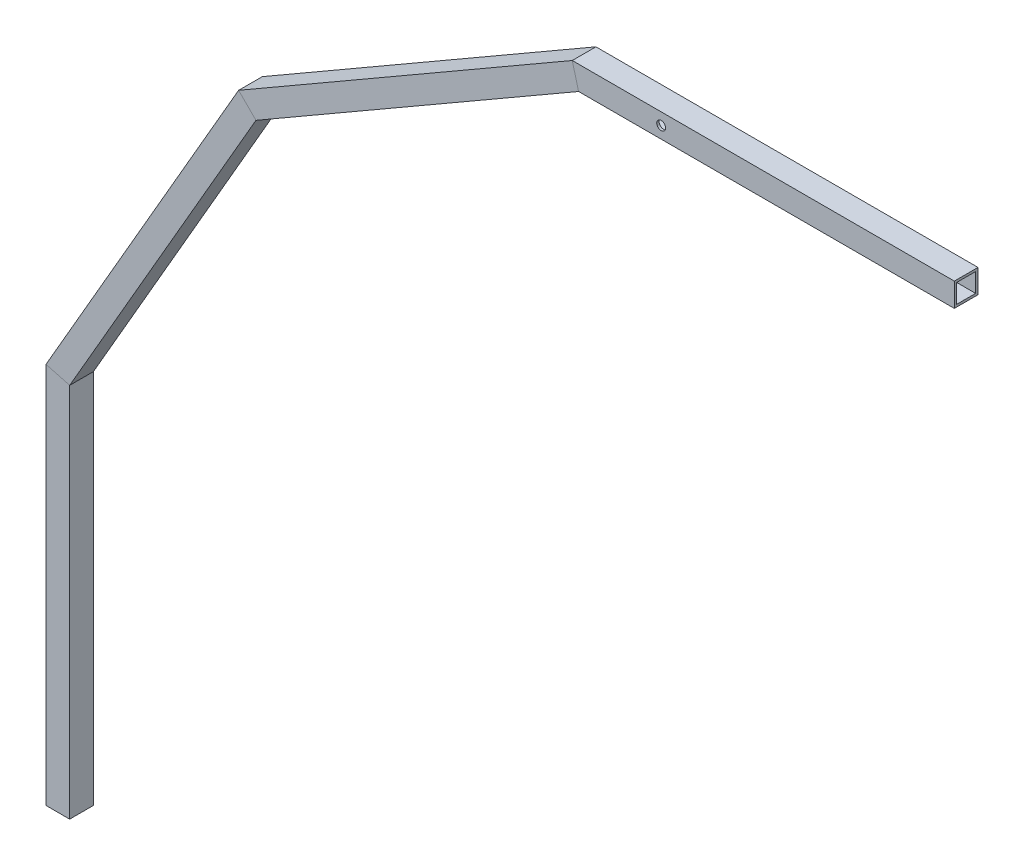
SolidWorks part; units mm, degrees
ref_plane "Front Plane" through (0, 0, 0) normal (0, 0, 1) x (1, 0, 0)
ref_plane "Top Plane" through (0, 0, 0) normal (0, 1, 0) x (1, 0, 0)
ref_plane "Right Plane" through (0, 0, 0) normal (1, 0, 0) x (0, 0, -1)
sketch "Sketch1" plane through (0, 0, 0) normal (0, 0, 1) x (1, 0, 0)
  line L0 (0, 0) -> (0, 406.4)
  line L1 (0, 406.4) -> (203.2, 758.3527)
  line L2 (203.2, 758.3527) -> (555.1527, 961.5527)
  line L3 (555.1527, 961.5527) -> (961.5527, 961.5527)
  dimension "D1" = 406.4
  dimension "D2" = 30
  dimension "D3" = 30
sketch "Sketch2" plane through (0, 0, 0) normal (0, 1, 0) x (1, 0, 0)
  line L0 (10.16, 10.16) -> (-10.16, 10.16)
  line L1 (12.7, 12.7) -> (-12.7, 12.7)
  line L2 (12.7, 12.7) -> (12.7, -12.7)
  line L3 (12.7, -12.7) -> (-12.7, -12.7)
  line L4 (-12.7, 12.7) -> (-12.7, -12.7)
  line L5 (12.7, 12.7) -> (-12.7, -12.7) construction
  line L6 (12.7, -12.7) -> (-12.7, 12.7) construction
  line L7 (-10.16, 10.16) -> (-10.16, -10.16)
  line L8 (10.16, -10.16) -> (-10.16, -10.16)
  line L9 (10.16, 10.16) -> (10.16, -10.16)
  point P0 (0, 0)
  dimension "D1" = 25.4
  dimension "D2" = 25.4
  dimension "D3" = 2.54
sweep "Sweep1" add profiles "Sketch2" path "Sketch1"
sketch "Sketch3" plane through (0, 0, 12.7) normal (0, 0, 1) x (1, 0, 0)
  line L0 (961.5527, 974.2527) -> (961.5527, 948.8527) construction
  circle A0 centre (647.1268, 961.5527) radius 4.7625
  point P5 (0, 0)
  point P6 (961.5527, 961.5527)
  dimension "D1" = 9.525
  dimension "D2" = 314.426
extrude "Cut-Extrude1" cut sketch "Sketch3" against normal through all
